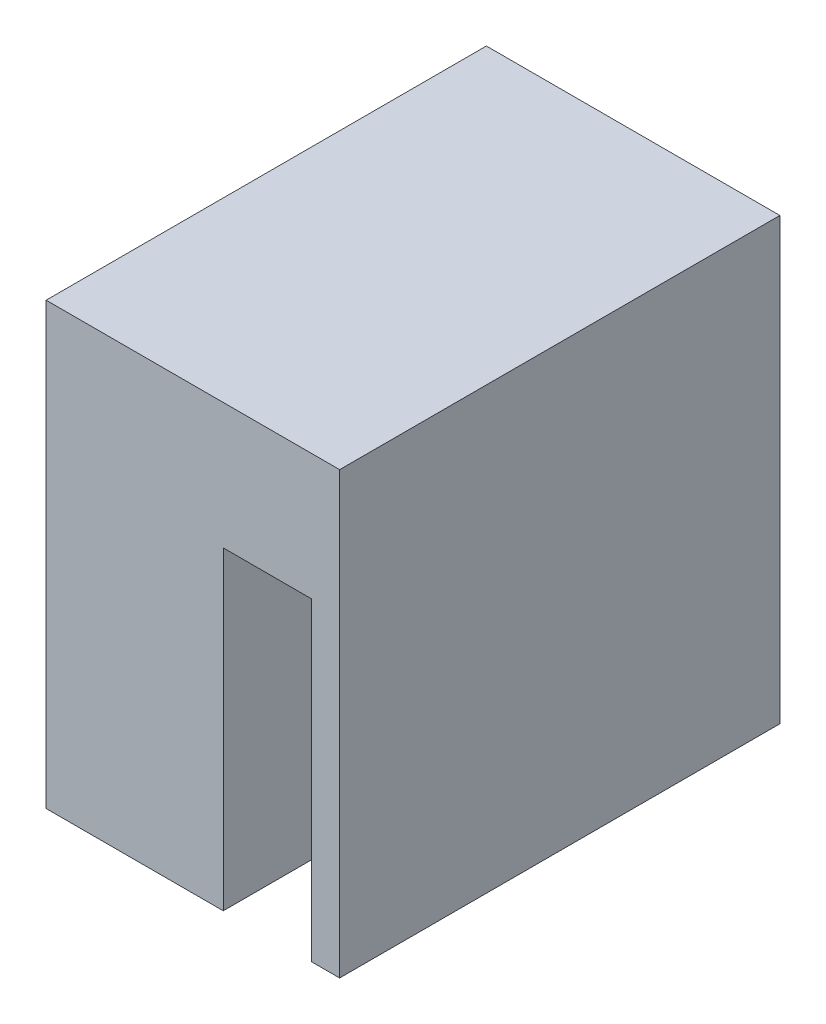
SolidWorks part; units mm, degrees
ref_plane "Plan de face" through (0, 0, 0) normal (0, 0, 1) x (1, 0, 0)
ref_plane "Plan de dessus" through (0, 0, 0) normal (0, 1, 0) x (1, 0, 0)
ref_plane "Plan de droite" through (0, 0, 0) normal (1, 0, 0) x (0, 0, -1)
sketch "Esquisse1" plane through (0, 0, 0) normal (0, 0, 1) x (1, 0, 0)
  line L1 (0, 0) -> (10, 0)
  line L2 (0, 0) -> (0, 15)
  line L3 (0, 15) -> (10, 15)
  line L4 (10, 0) -> (10, 15)
  line L5 (6.0354, 10.7089) -> (9.0354, 10.7089)
  line L6 (6.0354, 10.7089) -> (6.0354, 0)
  line L7 (6.0354, 0) -> (9.0354, 0)
  line L8 (9.0354, 10.7089) -> (9.0354, 0)
  dimension "D1" = 10
  dimension "D2" = 15
  dimension "D3" = 3
  dimension "D4" = 10.7089
extrude "Boss.-Extru.2" add sketch "Esquisse1" against normal blind 15 contours L5 L8 L1 L4 L3 L2 L6
sketch "Esquisse2" plane through (0, 0, 0) normal (-1, 0, 0) x (0, 0, 1)
  line L0 (-7.5, 15) -> (-7.5, -1.5154) construction
  line L1 (-15, 15) -> (0, 15) construction
  line L2 (-15, 7.5) -> (0, 7.5) construction
  line L3 (-15, 0) -> (-15, 15) construction
  line L4 (0, 0) -> (0, 15) construction
  circle A0 centre (-7.5, 7.5) radius 5.0069
extrude "Enlèv. mat.-Extru.1" cut sketch "Esquisse2" against normal blind 3
